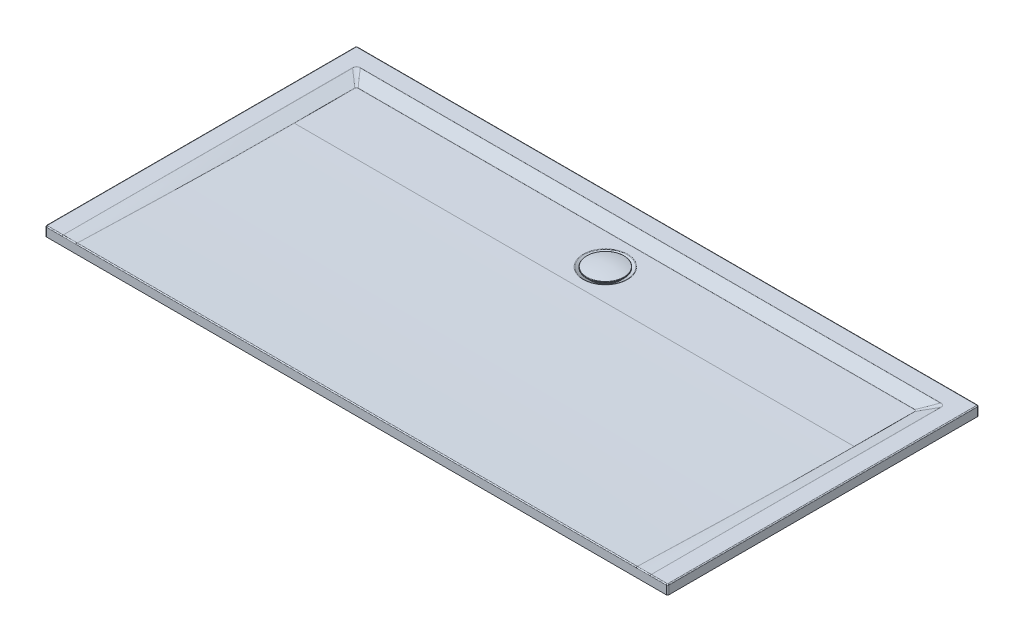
SolidWorks part; units mm, degrees
ref_plane "Płaszczyzna przednia" through (0, 0, 0) normal (0, 0, 1) x (1, 0, 0)
ref_plane "Płaszczyzna górna" through (0, 0, 0) normal (0, 1, 0) x (1, 0, 0)
ref_plane "Płaszczyzna prawa" through (0, 0, 0) normal (1, 0, 0) x (0, 0, -1)
sketch "Szkic1" plane through (0, 0, 0) normal (0, 1, 0) x (1, 0, 0)
  line L0 (0, 500) -> (0, -500) construction
  line L1 (-1000, 500) -> (1000, 500)
  line L2 (-1000, 500) -> (-1000, -500)
  line L3 (-1000, -500) -> (1000, -500)
  line L4 (1000, 500) -> (1000, -500)
  line L5 (-945, -500) -> (-945, 445)
  line L6 (-945, 445) -> (945, 445)
  line L7 (945, 445) -> (945, -500)
  line L8 (-900, -500) -> (-900, 400)
  line L9 (-900, 400) -> (900, 400)
  line L10 (900, 400) -> (900, -500)
  circle A0 centre (0, 300) radius 45
  circle A1 centre (0, 300) radius 70
  point P9 (0, 445)
  dimension "D6" = 90
  dimension "D7" = 140
  dimension "D1" = 2000
  dimension "D2" = 55
  dimension "D3" = 55
  dimension "D5" = 200
  dimension "D8" = 1000
  dimension "D4" = 45
sketch "Szkic2" plane through (0, 0, 0) normal (0, 1, 0) x (1, 0, 0)
  line L0 (-1000, -500) -> (1000, -500) construction
  line L1 (1000, 500) -> (1000, -500) construction
  line L2 (945, 445) -> (945, -500) construction
  line L3 (-945, 445) -> (945, 445) construction
  line L4 (-1000, 500) -> (1000, 500) construction
  line L5 (-945, -500) -> (-945, 445) construction
  line L6 (-1000, 500) -> (-1000, -500) construction
  line L7 (-1000, -500) -> (-945, -500)
  line L8 (1000, 500) -> (1000, -500)
  line L9 (945, 445) -> (945, -500)
  line L10 (-945, 445) -> (945, 445)
  line L11 (-1000, 500) -> (1000, 500)
  line L12 (-945, -500) -> (-945, 445)
  line L13 (-1000, 500) -> (-1000, -500)
  line L14 (945, -500) -> (1000, -500)
surface "Powierzchnia-Płaszczyzna1" sketch "Szkic2"
ref_plane "Płaszczyzna1" through (0, -15, 0) normal (0, 1, 0) x (-1, 0, 0)
sketch "Szkic3" plane through (0, -15, 0) normal (0, 1, 0) x (-1, 0, 0)
  line L0 (900, -200) -> (-900, -200)
  line L1 (900, 500) -> (900, -400) construction
  line L2 (-900, -400) -> (-900, 500) construction
  line L3 (0, -200) -> (0, -400) construction
  line L4 (900, -400) -> (-900, -400) construction
  line L5 (-900, -400) -> (-900, -200)
  line L6 (900, -200) -> (900, -400)
  line L7 (900, -400) -> (-900, -400)
  circle A0 centre (0, -300) radius 70 construction
  circle A1 centre (0, -300) radius 70
  point P10 (0, -300)
surface "Powierzchnia-Płaszczyzna2" sketch "Szkic3"
sketch "Szkic4" plane through (0, 0, 0) normal (0, 1, 0) x (1, 0, 0)
  line L0 (900, -500) -> (-900, -500)
other "Granica-Powierzchnia1"
other "Granica-Powierzchnia2"
other "Granica-Powierzchnia3"
mirror "Lustro1" about plane through (0, 0, 0) normal (1, 0, 0)
sketch "Szkic5" plane through (0, 0, 0) normal (0, 1, 0) x (1, 0, 0)
  line L0 (1000, 500) -> (1000, -500) construction
  line L1 (-1000, 500) -> (1000, 500) construction
  line L2 (-1000, 500) -> (-1000, -500) construction
  line L3 (-1000, -500) -> (1000, -500) construction
  line L4 (1000, 500) -> (1000, -500)
  line L5 (-1000, 500) -> (1000, 500)
  line L6 (-1000, 500) -> (-1000, -500)
  line L7 (-1000, -500) -> (1000, -500)
surface "Powierzchnia-Wyciągnięcie1" sketch "Szkic5" parameters "D1"=30
sketch "Szkic7" plane through (0, 0, 0) normal (1, 0, 0) x (0, 0, -1)
  line L0 (300, 0) -> (300, -30) construction
  line L1 (500, -30) -> (-500, -30) construction
  line L2 (345, -30) -> (345, -28)
  line L3 (345, -28) -> (349, -28)
  line L6 (349, -28) -> (370, -15)
  dimension "D1" = 90
  dimension "D2" = 2
  dimension "D3" = 98
surface "Powierzchnia-Obrót wokół linii środkowej1" sketch "Szkic7" parameters "D1"=360
surface "Powierzchnia-Płaszczyzna3"
surface "Powierzchnia-Połącz1"
fillet "Zaokrąglenie1" radius 4 6 edges at (0, -28, -349) (0, -15, -230) (1000, -15, 500) (1000, -15, -500) (-1000, -15, -500) (-1000, -15, 500)
fillet "Zmienne zaokrąglenie1" radius 40 2 edges at (922.5, -7.5, -422.5)
fillet "Zaokrąglenie3" radius 3 12 edges
fillet "Zaokrąglenie4" radius 3 12 edges at (-998.8284, 0, -498.8284) (0, 0, -500) (998.8284, 0, -498.8284) (1000, 0, 0) (998.8284, 0, 498.8284) (970.5, 0, 500) (-970.5, 0, 500) (-998.8284, 0, 498.8284) (-1000, 0, 0)
sketch "Szkic8" plane through (0, 0, 0) normal (1, 0, 0) x (0, 0, -1)
  line L0 (300, 0) -> (300, -30) construction
  line L1 (300, -5.6601) -> (179.8469, -5.6601) construction
  line L2 (360, -14.7573) -> (360, -17)
  line L3 (360, -17) -> (300, -17)
  line L4 (300, -17) -> (300, -5.6601)
  line L5 (300, -5.6601) -> (199.9922, 95.6514)
  arc A0 (300, -5.6601) -> (359.2694, -13.7943) centre (300, -225.6601) cw
  arc A1 (359.2694, -13.7943) -> (360, -14.7573) centre (359, -14.7573) cw
  point P11 (360, -14)
  dimension "D1" = 220
  dimension "D4" = 1
  dimension "D2" = 60
  dimension "D3" = 3
  dimension "D5" = 13
revolve "Obrót wokół linii środkowej1" add sketch "Szkic8" angle 360 about L4
